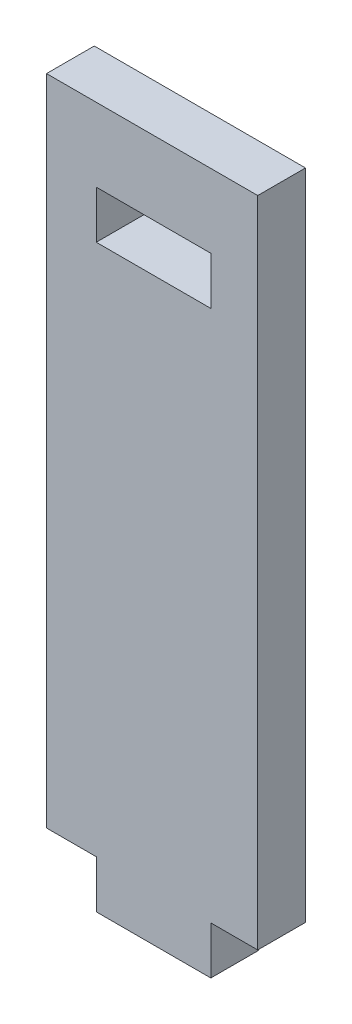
SolidWorks part; units mm, degrees
ref_plane "Front Plane" through (0, 0, 0) normal (0, 0, 1) x (1, 0, 0)
ref_plane "Top Plane" through (0, 0, 0) normal (0, 1, 0) x (1, 0, 0)
ref_plane "Right Plane" through (0, 0, 0) normal (1, 0, 0) x (0, 0, -1)
sketch "Sketch1" plane through (0, 0, 0) normal (0, 0, 1) x (1, 0, 0)
  line L0 (-12.27, -15.3125) -> (-12.27, -20.3125)
  line L1 (-17.48, 53.1274) -> (4.645, 53.1274)
  line L2 (-17.48, 53.1274) -> (-17.48, -15.3125)
  line L3 (-17.48, -15.3125) -> (-12.27, -15.3125)
  line L4 (4.645, 53.1274) -> (4.645, -15.3125)
  line L5 (-12.27, -20.3125) -> (-0.27, -20.3125)
  line L6 (-0.27, -20.3125) -> (-0.27, -15.3125)
  line L7 (-0.27, -15.3125) -> (4.645, -15.3125)
  line L8 (5.145, 48.3432) -> (5.145, 45.6299) construction
  line L10 (5.145, 45.6299) -> (-17.855, 45.6299) construction
  line L11 (-12.27, 45.4299) -> (-0.27, 45.4299)
  line L12 (-12.27, 45.4299) -> (-12.27, 40.4299)
  line L13 (-12.27, 40.4299) -> (-0.27, 40.4299)
  line L14 (-0.27, 45.4299) -> (-0.27, 40.4299)
  dimension "D1" = 5
  dimension "D2" = 12
  dimension "D3" = 4.915
  dimension "D4" = 0.5
  dimension "D5" = 0.5
  dimension "D6" = 5
  dimension "D7" = 12
  dimension "D8" = 0.2
extrude "Boss-Extrude1" add sketch "Sketch1" along normal blind 5
